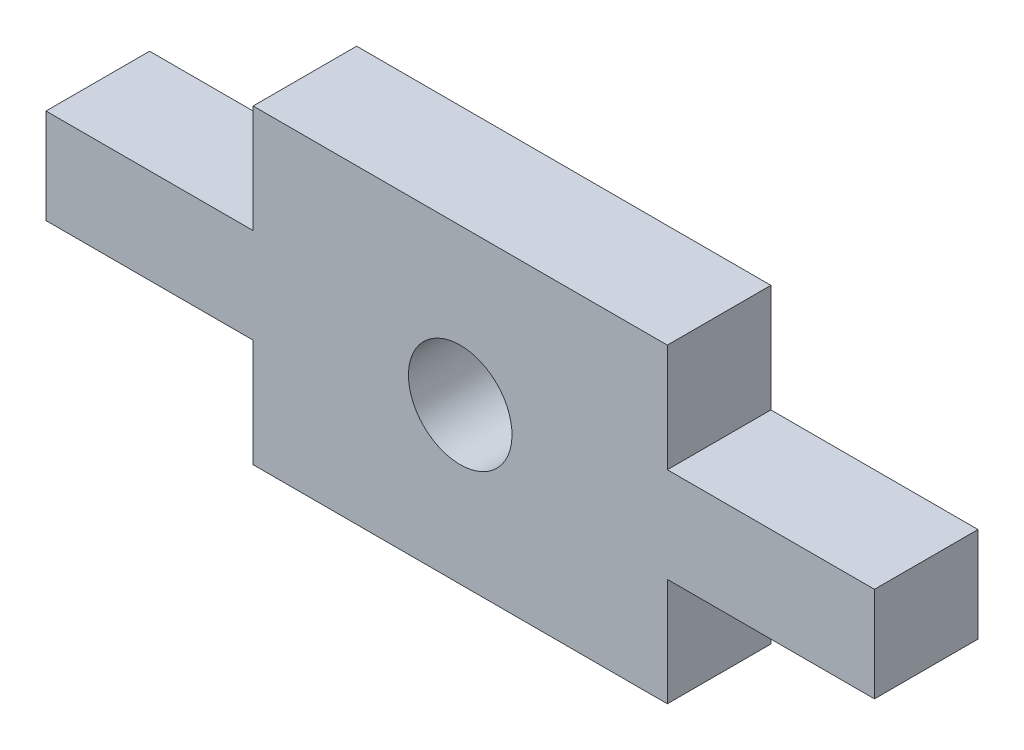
SolidWorks part; units mm, degrees
ref_plane "Front Plane" through (0, 0, 0) normal (0, 0, 1) x (1, 0, 0)
ref_plane "Top Plane" through (0, 0, 0) normal (0, 1, 0) x (1, 0, 0)
ref_plane "Right Plane" through (0, 0, 0) normal (1, 0, 0) x (0, 0, -1)
imported_body "Imported1"
sketch "Sketch2" plane through (0, 0, 0) normal (0, 0, 1) x (1, 0, 0)
  line L1 (-7.0425, 3.4215) -> (-13.4907, 3.4215)
  line L2 (-7.0425, 3.4215) -> (-7.0425, 0.295)
  line L3 (-7.0425, 0.295) -> (-13.4907, 0.295)
  line L4 (-13.4907, 3.4215) -> (-13.4907, 0.295)
  line L5 (-7.0425, -5.5785) -> (-13.4907, -5.5785)
  line L6 (-7.0425, -5.5785) -> (-7.0425, -2.455)
  line L7 (-7.0425, -2.455) -> (-13.4907, -2.455)
  line L8 (-13.4907, -5.5785) -> (-13.4907, -2.455)
  line L9 (4.9575, -5.5785) -> (11.4996, -5.5785)
  line L10 (4.9575, -5.5785) -> (4.9575, -2.455)
  line L11 (4.9575, -2.455) -> (11.4996, -2.455)
  line L12 (11.4996, -5.5785) -> (11.4996, -2.455)
  line L13 (4.9575, 3.4215) -> (11.4996, 3.4215)
  line L14 (4.9575, 3.4215) -> (4.9575, 0.295)
  line L15 (4.9575, 0.295) -> (11.4996, 0.295)
  line L16 (11.4996, 3.4215) -> (11.4996, 0.295)
extrude "Cut-Extrude1" cut sketch "Sketch2" against normal blind 3
